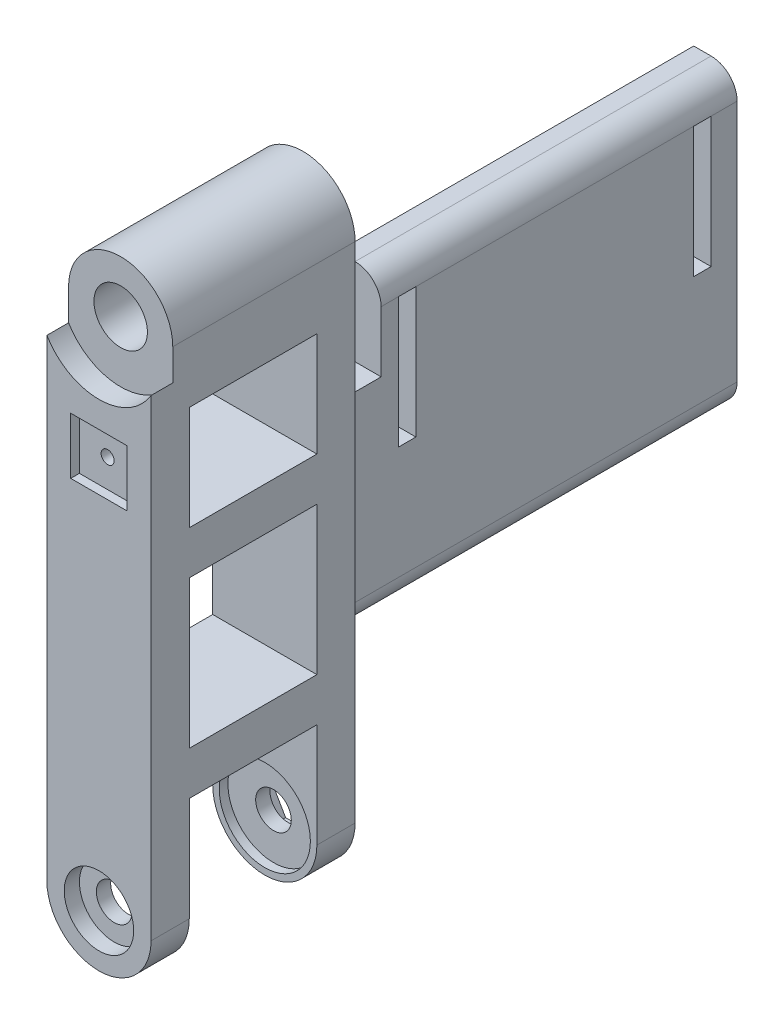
SolidWorks part; units mm, degrees
ref_plane "前视基准面" through (0, 0, 0) normal (0, 0, 1) x (1, 0, 0)
ref_plane "上视基准面" through (0, 0, 0) normal (0, 1, 0) x (1, 0, 0)
ref_plane "右视基准面" through (0, 0, 0) normal (1, 0, 0) x (0, 0, -1)
other "Configuration Table"
sketch "草图1" plane through (0, 0, 0) normal (0, 0, 1) x (1, 0, 0)
  line L2 (0, 0) -> (0, 58)
  line L4 (12, 0) -> (12, 58)
  arc A0 (0, 58) -> (12, 58) centre (6, 58) cw
  arc A1 (12, 0) -> (0, 0) centre (6, 0) cw
  circle A2 centre (6, 58) radius 3.08
  circle A3 centre (6, 0) radius 2.05
  dimension "D1" = 12
  dimension "D2" = 58
extrude "凸台-拉伸7" add sketch "草图1" against normal blind 25.5
sketch "草图6" plane through (12, 0, 0) normal (1, 0, 0) x (0, 0, -1)
  line L1 (5.4, -6) -> (20.1, -6)
  line L2 (5.4, -6) -> (5.4, 12)
  line L3 (5.4, 12) -> (20.1, 12)
  line L4 (20.1, -6) -> (20.1, 12)
  line L5 (0, 0) -> (0, -6) construction
  line L7 (5.4, 17) -> (20.1, 17)
  line L8 (5.4, 17) -> (5.4, 34)
  line L9 (5.4, 34) -> (20.1, 34)
  line L10 (20.1, 17) -> (20.1, 34)
  line L15 (5.4, 39) -> (20.1, 39)
  line L24 (5.4, 39) -> (5.4, 51)
  line L25 (5.4, 51) -> (20.1, 51)
  line L26 (20.1, 39) -> (20.1, 51)
  dimension "D6" = 12
  dimension "D1" = 14.7
  dimension "D2" = 5.4
  dimension "D3" = 5
  dimension "D4" = 5
  dimension "D5" = 17
extrude "切除-拉伸1" cut sketch "草图6" against normal blind 20
sketch "草图7" plane through (0, 0, 0) normal (0, 0, 1) x (1, 0, 0)
  circle A0 centre (6, 0) radius 3.15
extrude "切除-拉伸2" cut sketch "草图7" against normal blind 2.75
sketch "草图8" plane through (0, 0, -25.5) normal (0, 0, -1) x (-1, 0, 0)
  line L1 (-2.6514, 0) -> (-4.3257, 2.9)
  line L2 (-4.3257, 2.9) -> (-7.6743, 2.9)
  line L3 (-7.6743, 2.9) -> (-9.3486, 0)
  line L4 (-9.3486, 0) -> (-7.6743, -2.9)
  line L5 (-7.6743, -2.9) -> (-4.3257, -2.9)
  line L6 (-4.3257, -2.9) -> (-2.6514, 0)
  circle A0 centre (-6, 0) radius 2.9 construction
extrude "切除-拉伸3" cut sketch "草图8" against normal blind 2.75
sketch "草图9" plane through (0, 0, 0) normal (0, 0, 1) x (1, 0, 0)
  line L0 (6, 58) -> (6, 53) construction
  line L1 (6, 53) -> (6, 48) construction
  line L2 (6, 48) -> (6, 37.6649) construction
  line L3 (2.75, 48) -> (9.25, 48)
  line L4 (2.75, 48) -> (2.75, 41.5)
  line L5 (2.75, 41.5) -> (9.25, 41.5)
  line L6 (9.25, 48) -> (9.25, 41.5)
  point P8 (6, 48)
  dimension "D1" = 5
  dimension "D2" = 5
  dimension "D3" = 6.5
  dimension "D4" = 6.5
extrude "切除-拉伸4" cut sketch "草图9" against normal blind 2
sketch "草图11" plane through (0, 0, -2) normal (0, 0, 1) x (1, 0, 0)
  line L0 (6, 48) -> (6, 41.5) construction
  line L1 (9.25, 48) -> (2.75, 48) construction
  line L2 (2.75, 41.5) -> (9.25, 41.5) construction
  circle A0 centre (6, 44.75) radius 0.75
  dimension "D1" = 3.25
extrude "切除-拉伸5" cut sketch "草图11" against normal up to surface (3.4 mm away)
sketch "草图12" plane through (0, 0, -25.5) normal (0, 0, -1) x (-1, 0, 0)
  line L2 (0, 12) -> (0, 36)
  line L3 (0, 36) -> (-5, 36)
  line L4 (-5, 12) -> (-5, 36)
  line L5 (0, 58) -> (0, 0) construction
  line L6 (-5, 12) -> (0, 12)
  circle A0 centre (-6, 0) radius 2.05 construction
  point P11 (-2.5, 36)
  dimension "D1" = 0
  dimension "D2" = 5
  dimension "D3" = 24
  dimension "D4" = 12
extrude "凸台-拉伸8" add sketch "草图12" along normal blind 50
sketch "草图14" plane through (0, 0, -25.5) normal (0, 0, -1) x (-1, 0, 0)
  circle A0 centre (-6, 58) radius 7
sketch "草图15" plane through (0, 0, 0) normal (0, 0, 1) x (1, 0, 0)
  circle A0 centre (6, 58) radius 7
extrude "切除-拉伸8" cut sketch "草图15" against normal blind 3.5
sketch "草图16" plane through (0, 0, -25.5) normal (0, 0, -1) x (-1, 0, 0)
  line L0 (0, 54.3944) -> (0, 36)
  line L1 (0, 36) -> (-5, 36)
  line L2 (-5, 36) -> (-5, 12)
  line L3 (-5, 12) -> (0, 12)
  line L4 (0, 12) -> (0, 0)
  line L5 (-12, 54.3944) -> (-12, 0)
  arc A0 (-12, 54.3944) -> (0, 54.3944) centre (-6, 58) ccw
  arc A1 (-12, 0) -> (0, 0) centre (-6, 0) ccw
extrude "切除-拉伸9" cut sketch "草图16" against normal blind 1
sketch "草图17" plane through (0, 0, 0) normal (0, 0, 1) x (1, 0, 0)
  line L0 (12, 54.3944) -> (12, 0)
  line L1 (0, 54.3944) -> (0, 0)
  arc A0 (0, 54.3944) -> (12, 54.3944) centre (6, 58) ccw
  arc A1 (0, 0) -> (12, 0) centre (6, 0) ccw
extrude "切除-拉伸10" cut sketch "草图17" against normal blind 1
sketch "草图18" plane through (0, 0, -20.1) normal (0, 0, 1) x (1, 0, 0)
  circle A0 centre (6, 0) radius 5.25
extrude "切除-拉伸11" cut sketch "草图18" against normal blind 1
sketch "草图20" plane through (0, 0, -5.4) normal (0, 0, -1) x (-1, 0, 0)
  circle A0 centre (-5.8704, 0) radius 5.25
  circle A1 centre (-6, 0) radius 2.05 construction
  dimension "D1" = 0
extrude "切除-拉伸12" cut sketch "草图20" against normal blind 1
extrude "切除-拉伸15" cut sketch "草图14" against normal blind 1
sketch "草图21" plane through (0, 36, 0) normal (0, 1, 0) x (1, 0, 0)
  line L0 (5, 75.5) -> (5, 24.5) construction
  line L1 (0, 75.5) -> (5, 75.5)
  line L2 (0, 75.5) -> (0, 34.5)
  line L3 (0, 34.5) -> (5, 34.5)
  line L4 (5, 75.5) -> (5, 34.5)
  line L5 (5, 24.5) -> (0, 24.5) construction
  dimension "D1" = 10
extrude "凸台-拉伸9" add sketch "草图21" along normal blind 10
sketch "草图13" plane through (5, 0, 0) normal (1, 0, 0) x (0, 0, -1)
  line L1 (36.5, 43) -> (38.5, 43)
  line L2 (36.5, 43) -> (36.5, 28)
  line L3 (36.5, 28) -> (38.5, 28)
  line L4 (38.5, 43) -> (38.5, 28)
  line L6 (75.5, 46) -> (75.5, 12) construction
  line L7 (70.5, 43) -> (72.5, 43)
  line L8 (70.5, 43) -> (70.5, 28)
  line L9 (70.5, 28) -> (72.5, 28)
  line L10 (72.5, 43) -> (72.5, 28)
  line L11 (34.5, 46) -> (75.5, 46) construction
  dimension "D1" = 15
  dimension "D2" = 3
  dimension "D3" = 2
  dimension "D4" = 2
  dimension "D5" = 3
  dimension "D6" = 0
  dimension "D7" = 0
  dimension "D8" = 32
extrude "切除-拉伸6" cut sketch "草图13" against normal blind 30
fillet "圆角2" radius 3 2 edges at (5, 12, -50) (5, 46, -55)
sketch "草图22" plane through (0, 0, -1) normal (0, 0, 1) x (1, 0, 0)
  circle A0 centre (6, 0) radius 4
extrude "切除-拉伸16" cut sketch "草图22" against normal up to surface (1.75 mm away)
sketch "草图23" plane through (0, 0, -24.5) normal (0, 0, -1) x (-1, 0, 0)
  line L1 (-2, 0) -> (-4, 3.4641)
  line L2 (-4, 3.4641) -> (-8, 3.4641)
  line L3 (-8, 3.4641) -> (-10, 0)
  line L4 (-10, 0) -> (-8, -3.4641)
  line L5 (-8, -3.4641) -> (-4, -3.4641)
  line L6 (-4, -3.4641) -> (-2, 0)
  circle A0 centre (-6, 0) radius 3.4641 construction
  dimension "D1" = 4
extrude "切除-拉伸17" cut sketch "草图23" against normal up to surface (1.75 mm away)
